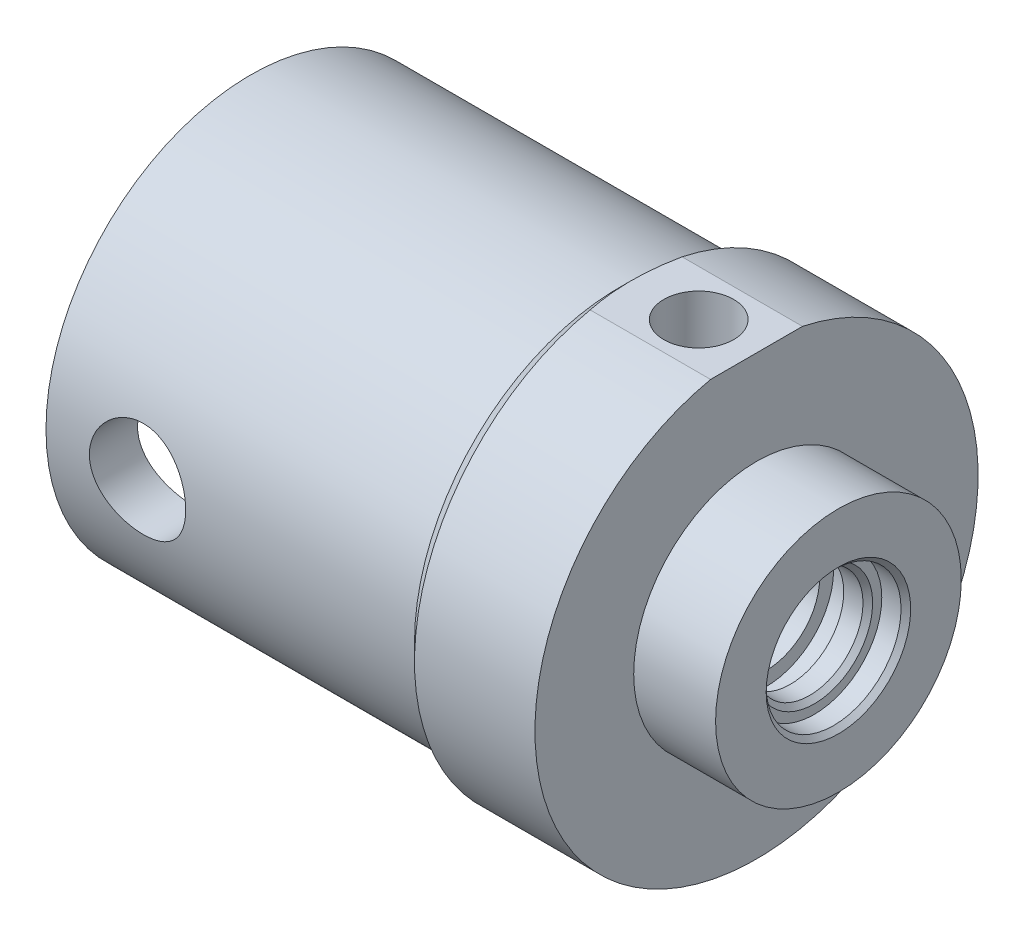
SolidWorks part; units mm, degrees
ref_plane "Face" through (0, 0, 0) normal (0, 0, 1) x (1, 0, 0)
ref_plane "Dessus" through (0, 0, 0) normal (0, 1, 0) x (1, 0, 0)
ref_plane "Droite" through (0, 0, 0) normal (1, 0, 0) x (0, 0, -1)
sketch "Esquisse1" plane through (0, 0, 0) normal (0, 0, 1) x (1, 0, 0)
  line L0 (0, 0) -> (148.1373, 0) construction
  line L1 (0, 0) -> (0, 42.5)
  line L2 (0, 42.5) -> (76.5, 42.5)
  line L3 (76.5, 42.5) -> (80, 46)
  line L4 (80, 46) -> (105, 46)
  line L5 (105, 46) -> (105, 25.5)
  line L6 (105, 25.5) -> (122, 25.5)
  line L7 (122, 25.5) -> (122, 0)
  line L8 (122, 0) -> (0, 0)
  dimension "D1" = 46
  dimension "D2" = 25.5
  dimension "D3" = 42.5
  dimension "D4" = 135
  dimension "D5" = 122
  dimension "D6" = 17
  dimension "D7" = 80
revolve "Révolution1" add sketch "Esquisse1" angle 360 about L0
sketch "Esquisse2" plane through (0, 0, 0) normal (0, 0, 1) x (1, 0, 0)
  line L0 (0, 0) -> (0, 36)
  line L1 (0, 42.5) -> (0, -42.5) construction
  line L2 (0, 36) -> (3, 36)
  line L3 (3, 36) -> (3, 37.5)
  line L4 (3, 37.5) -> (7, 37.5)
  line L5 (7, 37.5) -> (7, 32.5)
  line L6 (7, 32.5) -> (30.2525, 32.5)
  line L7 (30.2525, 32.5) -> (33, 31.5)
  line L8 (33, 31.5) -> (88, 31.5)
  line L9 (88, 31.5) -> (88, 11.1)
  line L10 (88, 11.1) -> (92.4, 11.1)
  line L11 (92.4, 11.1) -> (92.4, 14)
  line L12 (92.4, 14) -> (102, 14)
  line L13 (102, 14) -> (102, 11.1)
  line L14 (102, 11.1) -> (107, 11.1)
  line L15 (107, 11.1) -> (107, 14)
  line L16 (107, 14) -> (112, 14)
  line L17 (112, 14) -> (112, 11.1)
  line L18 (112, 11.1) -> (117, 11.1)
  line L19 (117, 11.1) -> (117, 14)
  line L20 (117, 14) -> (122, 14)
  line L21 (122, -25.5) -> (122, 25.5) construction
  line L22 (122, 14) -> (122, 0)
  line L23 (122, 0) -> (0, 0)
  dimension "D1" = 11.1
  dimension "D2" = 14
  dimension "D3" = 5
  dimension "D4" = 10
  dimension "D5" = 5
  dimension "D6" = 20
  dimension "D7" = 9.6
  dimension "D8" = 88
  dimension "D9" = 3
  dimension "D10" = 4
  dimension "D11" = 33
  dimension "D12" = 160
  dimension "D13" = 31.5
  dimension "D14" = 32.5
  dimension "D15" = 37.5
  dimension "D16" = 36
revolve "Enlèvement de matière-Révolution1" cut sketch "Esquisse2" angle 360 about L23
chamfer "Chanfrein1" distance 1 angle 45 2 edges at (117, 0, -11.1) (122, 0, -14)
sketch "Esquisse4" plane through (105, 0, 0) normal (1, 0, 0) x (0, 0, -1)
  line L1 (72.23, 45) -> (-59.9876, 45)
  line L2 (72.23, 45) -> (72.23, 75.7808)
  line L3 (72.23, 75.7808) -> (-59.9876, 75.7808)
  line L4 (-59.9876, 45) -> (-59.9876, 75.7808)
  dimension "D1" = 45
extrude "Enlèv. mat.-Extru.1" cut sketch "Esquisse4" against normal through all
hole_wizard "Trou taraudé G3/8" positions "Esquisse6" profile "Esquisse5" tap size "M16x1.5" standard "Ansi Métrique"
sketch "Esquisse6" plane through (0, 45, 0) normal (0, 1, 0) x (-1, 0, 0)
  line L0 (-105, -9.5394) -> (-105, 9.5394) construction
  line L1 (0, 0) -> (-148.1373, 0) construction
  point P0 (-93, 0)
  dimension "D1" = 12
sketch "Esquisse5" plane through (93, 45, 0) normal (1, 0, 0) x (0, 0, 1)
  line L0 (0, 0) -> (0, 26.8562)
  line L1 (0, 26.8562) -> (7.25, 22.5)
  line L2 (7.25, 22.5) -> (7.25, 0)
  line L5 (7.25, 0) -> (0, 0)
  line L10 (0, 26.8562) -> (-7.25, 22.5) construction
  line L11 (0, -6.35) -> (0, 107.95) construction
  dimension "Diamètre du trou pour taraudage" = 14.5
  dimension "Profondeur du trou pour taraudage" = 22.5
  dimension "Angle de pointe" = 118
ref_plane "Plan1" through (0, 0, 0) normal (0, 0, 1) x (1, 0, 0)
sketch "Esquisse7" plane through (0, 0, 0) normal (0, 0, 1) x (1, 0, 0)
  line L0 (0, 0) -> (148.1373, 0) construction
  line L1 (0, 42.5) -> (0, -42.5) construction
  circle A0 centre (19, 0) radius 10
  dimension "D1" = 20
  dimension "D2" = 19
extrude "Enlèv. mat.-Extru.2" cut sketch "Esquisse7" against normal through all and the other way through all
